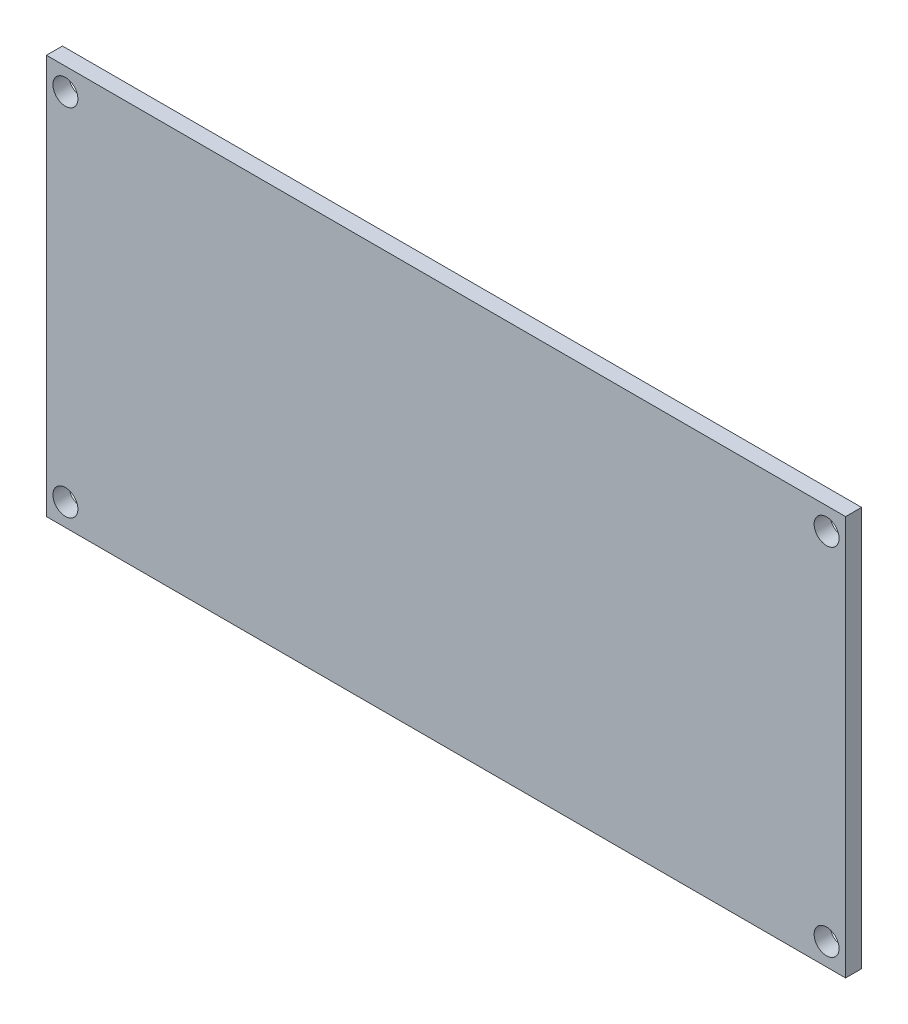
SolidWorks part; units mm, degrees
ref_plane "Plan de face" through (0, 0, 0) normal (0, 0, 1) x (1, 0, 0)
ref_plane "Plan de dessus" through (0, 0, 0) normal (0, 1, 0) x (1, 0, 0)
ref_plane "Plan de droite" through (0, 0, 0) normal (1, 0, 0) x (0, 0, -1)
sketch "Esquisse1" plane through (0, 0, 0) normal (0, 0, 1) x (1, 0, 0)
  line L0 (-52.31, 0) -> (52.0412, 0) construction
  line L1 (-40, 20) -> (40, 20)
  line L2 (-40, 20) -> (-40, -20)
  line L3 (-40, -20) -> (40, -20)
  line L4 (40, 20) -> (40, -20)
  line L5 (0, -26.6086) -> (0, 23.9572) construction
  circle A0 centre (-38.1, 17.78) radius 1.25
  circle A1 centre (-38.1, -17.78) radius 1.25
  circle A2 centre (38.1, -17.78) radius 1.25
  circle A3 centre (38.1, 17.78) radius 1.25
  dimension "D3" = 2.5
  dimension "D5" = 76.2
  dimension "D1" = 80
  dimension "D2" = 40
  dimension "D4" = 35.56
extrude "Boss.-Extru.1" add sketch "Esquisse1" along normal blind 1.6
